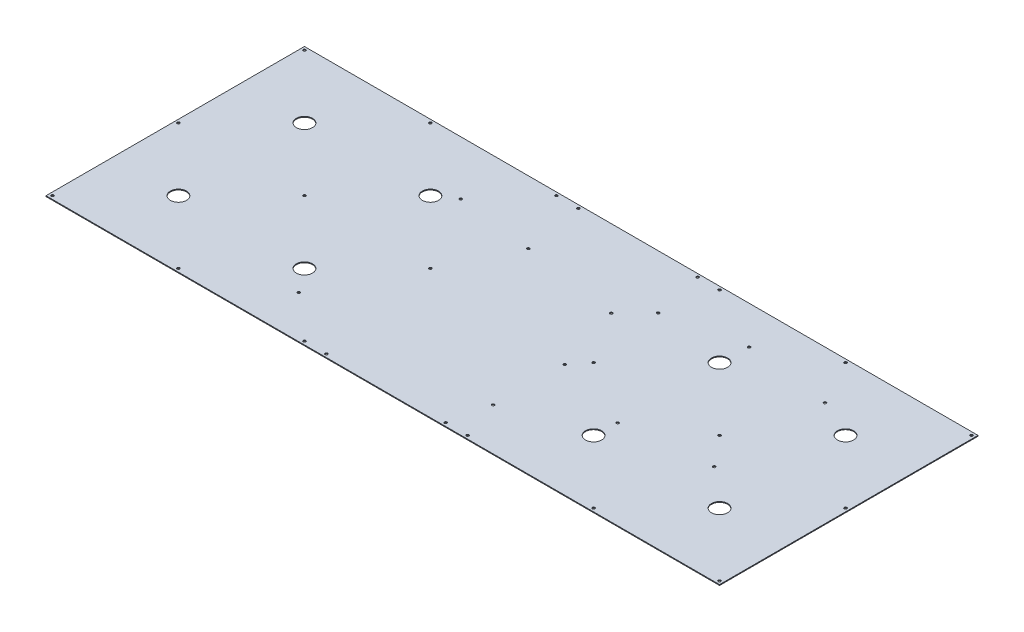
SolidWorks part; units mm, degrees
ref_plane "Front Plane" through (0, 0, 0) normal (0, 0, 1) x (1, 0, 0)
ref_plane "Top Plane" through (0, 0, 0) normal (0, 1, 0) x (1, 0, 0)
ref_plane "Right Plane" through (0, 0, 0) normal (1, 0, 0) x (0, 0, -1)
sketch "main_plate" plane through (0, 0, 0) normal (0, 1, 0) x (1, 0, 0)
  line L1 (-417, 160) -> (417, 160)
  line L2 (-417, 160) -> (-417, -160)
  line L3 (-417, -160) -> (417, -160)
  line L4 (417, 160) -> (417, -160)
  line L5 (-417, 160) -> (417, -160) construction
  line L6 (-417, -160) -> (417, 160) construction
  point P0 (0, 0)
  dimension "D1" = 320
  dimension "D2" = 834
extrude "Boss-Extrude1" add sketch "main_plate" along normal blind 1.016
sketch "main_holes" plane through (0, 1.016, 0) normal (0, 1, 0) x (1, 0, 0)
  line L0 (-417, 160) -> (-417, -160) construction
  line L1 (417, 160) -> (-417, 160) construction
  line L2 (-417, 0) -> (417, 0) construction
  line L3 (417, -160) -> (417, 160) construction
  line L4 (-417, -160) -> (417, -160) construction
  line L5 (0, 160) -> (0, -160) construction
  circle A0 centre (-413, 156) radius 1.6
  circle A6 centre (-257, 156) radius 1.6
  circle A7 centre (-101, 156) radius 1.6
  circle A8 centre (-257, 0) radius 1.6
  circle A9 centre (-101, 0) radius 1.6
  circle A10 centre (-257, -156) radius 1.6
  circle A11 centre (-101, -156) radius 1.6
  circle A12 centre (-413, 0) radius 1.6
  circle A13 centre (-413, -156) radius 1.6
  circle A18 centre (413, -156) radius 1.6
  circle A19 centre (413, 0) radius 1.6
  circle A20 centre (101, -156) radius 1.6
  circle A21 centre (257, -156) radius 1.6
  circle A22 centre (101, 0) radius 1.6
  circle A23 centre (257, 0) radius 1.6
  circle A24 centre (101, 156) radius 1.6
  circle A25 centre (257, 156) radius 1.6
  circle A28 centre (413, 156) radius 1.6
  circle A29 centre (-73.8188, 156) radius 1.6
  circle A31 centre (73.8188, 156) radius 1.6
  circle A32 centre (73.8188, -156) radius 1.6
  circle A33 centre (-73.8188, -156) radius 1.6
  dimension "D3" = 3.2
  dimension "D1" = 4
  dimension "D2" = 4
  dimension "D4" = 3
  dimension "D5" = 3
  dimension "D6" = 73.8188
extrude "Cut-Extrude1" cut sketch "main_holes" against normal through all
sketch "sma" plane through (0, 1.016, 0) normal (0, 1, 0) x (1, 0, 0)
  line L0 (0, 160) -> (0, -160) construction
  line L1 (417, 160) -> (-417, 160) construction
  line L2 (-417, -160) -> (417, -160) construction
  line L3 (-413, 156) -> (-257, 156) construction
  line L7 (-257, 0) -> (-413, 0) construction
  line L8 (-413, 0) -> (-413, 156) construction
  line L9 (-257, 156) -> (-257, 0) construction
  circle A0 centre (-335, 78) radius 10
  circle A1 centre (-179, 78) radius 10
  circle A2 centre (-179, -78) radius 10
  circle A3 centre (-335, -78) radius 10
  circle A4 centre (335, 78) radius 10
  circle A5 centre (179, 78) radius 10
  circle A6 centre (335, -78) radius 10
  circle A7 centre (179, -78) radius 10
  point P9 (-413, 78)
  point P10 (-335, 156)
  dimension "D1" = 20
  dimension "D2" = 2
  dimension "D3" = 2
extrude "Cut-Extrude2" cut sketch "sma" against normal through all
sketch "Sketch1"
sketch_block_instance "Block7-3"
sketch_block "Block7" parameters "D3"=3.2, "D1"=215.9, "D2"=259.71, "D4"=6.48, "D5"=7.24, "D6"=111, "D7"=103.38, "D8"=18.04, "D9"=12.3976, "D10"=37.52, "D11"=11.13, "D12"=13.84, "D13"=110.43, "D14"=101.73, "D15"=7.74, "D16"=6.47, "D17"=37.51, "D18"=13.68, "D19"=8.76, "D20"=15.4, "D21"=8.22, "D22"=100.94, "D23"=7.02, "D24"=8.34, "D25"=18.41, "D26"=36.31, "D27"=27.78, "D28"=7.02, "D29"=8.22, "D30"=9.18, "D31"=73.31, "D32"=73.31, "D33"=82.56, "D34"=105.32, "D35"=95.85
sketch_block_instance "Block8-7"
sketch_block "Block8" parameters "D6"=3.2, "D1"=217.932, "D2"=70.358, "D3"=61.468, "D4"=193.04, "D5"=18.796, "D7"=81.28, "D8"=68.58, "D9"=94.71, "D10"=106.68, "D11"=7.2423, "D12"=10.162, "D13"=153.2296, "D14"=101.3549, "D15"=17.0315, "D16"=3.5618, "D17"=32.417, "D18"=13.2495, "D19"=3.4527, "D20"=8.4803, "D21"=3.9066, "D22"=106.752, "D23"=204.8681, "D24"=9.2076, "D25"=24.3883, "D26"=33.6172, "D27"=18.1411, "D28"=6.4986, "D29"=209.249, "D30"=9.6327, "D31"=79.4294, "D32"=79.4294, "D33"=95.4165, "D34"=105.378, "D35"=97.6492
sketch "Sketch3" plane through (0, 1.016, 0) normal (0, 1, 0) x (1, 0, 0)
  point P0 (0, 0)
  line B0 (-163.2752, -115.6705) -> (96.4348, -115.6705) construction
  line B1 (96.4348, 100.2295) -> (96.4348, -115.6705) construction
  line B2 (67.1184, 66.8966) -> (67.1184, -3.4614) construction
  line B3 (-163.2752, -115.6705) -> (96.4348, 100.2295) construction
  line B4 (85.9144, 128.1106) -> (303.8464, -64.9294) construction
  line B5 (67.1184, 31.7176) -> (303.8464, 31.5906) construction
  circle B6 centre (180.6244, 112.9368) radius 1.6
  circle B7 centre (287.3044, 100.1795) radius 1.6
  circle B8 centre (287.2308, -36.9805) radius 1.6
  circle B9 centre (180.5372, -49.6232) radius 1.6
  circle B10 centre (-156.7952, 93.2095) radius 1.6
  circle B11 centre (-149.5552, 91.8895) radius 1.6
  circle B12 centre (-155.5352, -100.2705) radius 1.6
  circle B13 centre (-156.8052, -107.4505) radius 1.6
  circle B14 centre (-14.5652, -42.3605) radius 1.6
  circle B15 centre (-6.9452, -42.3605) radius 1.6
  circle B16 centre (58.9148, -33.1105) radius 1.6
  circle B17 centre (-52.8452, -14.7305) radius 1.6
  circle B18 centre (85.3048, -19.8205) radius 1.6
  circle B19 centre (82.5948, -10.3505) radius 1.6
  circle B20 centre (78.3948, -106.4905) radius 1.6
  circle B21 centre (84.0372, -107.4505) radius 1.6
  circle B22 centre (58.9248, 63.9195) radius 1.6
  circle B23 centre (82.7548, 72.4495) radius 1.6
  circle B24 centre (87.6748, 93.2095) radius 1.6
  circle B25 centre (-61.5452, 81.8195) radius 1.6
  line B26 (85.9144, 128.1106) -> (303.8464, 128.1106) construction
  line B27 (85.9144, 128.1106) -> (85.9144, 66.8966) construction
  line B28 (85.9144, -64.9294) -> (303.8464, -64.9294) construction
  line B29 (303.8464, 128.1106) -> (303.8464, -64.9294) construction
  line B30 (85.9144, -64.9294) -> (303.8464, 128.1106) construction
  line B31 (67.1184, 66.8966) -> (85.9144, 66.8966) construction
  line B32 (67.1184, -3.4614) -> (85.9144, -3.4614) construction
  line B33 (85.9144, -64.9294) -> (85.9144, -3.4614) construction
  line B34 (-163.2752, 100.2295) -> (96.4348, 100.2295) construction
  line B35 (-163.2752, 100.2295) -> (-163.2752, -115.6705) construction
  line B36 (-163.2752, 100.2295) -> (96.4348, -115.6705) construction
sketch_block_instance "Block9-1"
sketch_block "Block9"
sketch_block_instance "Block8-8"
sketch_block_instance "Block7-4"
extrude "Cut-Extrude3" cut sketch "Sketch3" against normal through all contours B10 | B13 | B21 | B24 | B6 | B7 | B8 | B9 | B25 | B18 | B22
